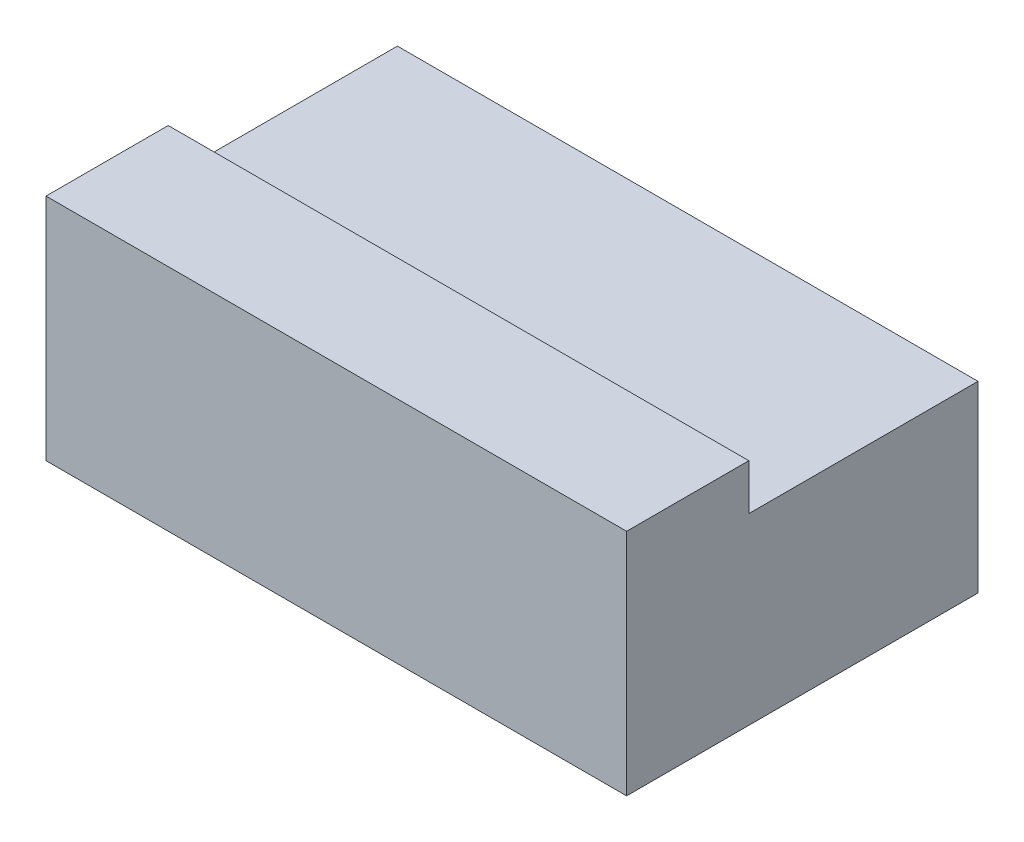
SolidWorks part; units mm, degrees
ref_plane "Front Plane" through (0, 0, 0) normal (0, 0, 1) x (1, 0, 0)
ref_plane "Top Plane" through (0, 0, 0) normal (0, 1, 0) x (1, 0, 0)
ref_plane "Right Plane" through (0, 0, 0) normal (1, 0, 0) x (0, 0, -1)
sketch "Sketch1" plane through (0, 0, 0) normal (0, 1, 0) x (1, 0, 0)
  line L1 (-95, 57.5) -> (95, 57.5)
  line L2 (-95, 57.5) -> (-95, -57.5)
  line L3 (-95, -57.5) -> (95, -57.5)
  line L4 (95, 57.5) -> (95, -57.5)
  line L5 (-95, 57.5) -> (95, -57.5) construction
  line L6 (-95, -57.5) -> (95, 57.5) construction
  point P0 (0, 0)
  dimension "D1" = 190
  dimension "D2" = 115
extrude "Boss-Extrude1" add sketch "Sketch1" along normal mid plane 75
sketch "Sketch5" plane through (0, 37.5, 0) normal (0, 1, 0) x (1, 0, 0)
  line L0 (95, -57.5) -> (95, 57.5) construction
  line L1 (-95, 57.5) -> (95, 57.5)
  line L2 (-95, 57.5) -> (-95, -17.5)
  line L3 (-95, -17.5) -> (95, -17.5)
  line L4 (95, 57.5) -> (95, -17.5)
  dimension "D1" = 75
extrude "Cut-Extrude4" cut sketch "Sketch5" against normal blind 15
